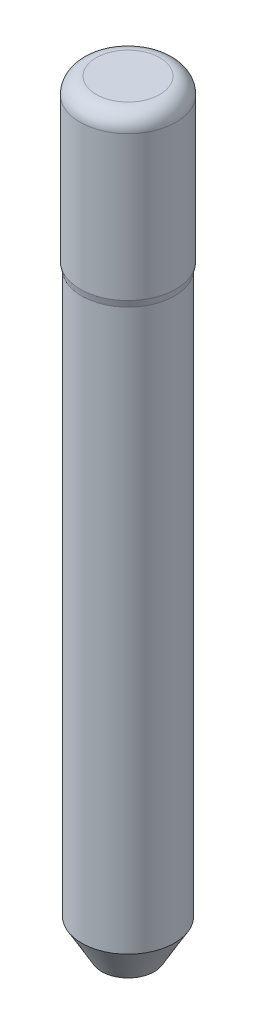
SolidWorks part; units mm, degrees
ref_plane "Front Plane" through (0, 0, 0) normal (0, 0, 1) x (1, 0, 0)
ref_plane "Top Plane" through (0, 0, 0) normal (0, 1, 0) x (1, 0, 0)
ref_plane "Right Plane" through (0, 0, 0) normal (1, 0, 0) x (0, 0, -1)
sketch "Sketch1" plane through (0, 0, 0) normal (0, 0, 1) x (1, 0, 0)
  line L0 (0, 0) -> (0, 59.5206) construction
  line L1 (0, -1.969) -> (0, 1.969) construction
  line L2 (0, 0) -> (0.9844, 0)
  line L3 (0.9844, 0) -> (1.735, 1.3)
  line L4 (1.735, 1.3) -> (1.735, 22.246)
  line L5 (1.735, 22.246) -> (1.79, 22.5)
  line L6 (1.79, 22.5) -> (1.79, 27.9)
  line L7 (1.19, 28.5) -> (0, 28.5)
  line L8 (0, 28.5) -> (0, 0)
  arc A0 (1.79, 27.9) -> (1.19, 28.5) centre (1.19, 27.9) ccw
  point P18 (1.79, 28.5)
  dimension "D8" = 0.6
  dimension "D1" = 3.58
  dimension "D2" = 3.47
  dimension "D3" = 28.5
  dimension "D4" = 6
  dimension "D5" = 30
  dimension "D6" = 1.3
  dimension "D7" = 0.254
revolve "Revolve1" add sketch "Sketch1" angle 360 about L0
